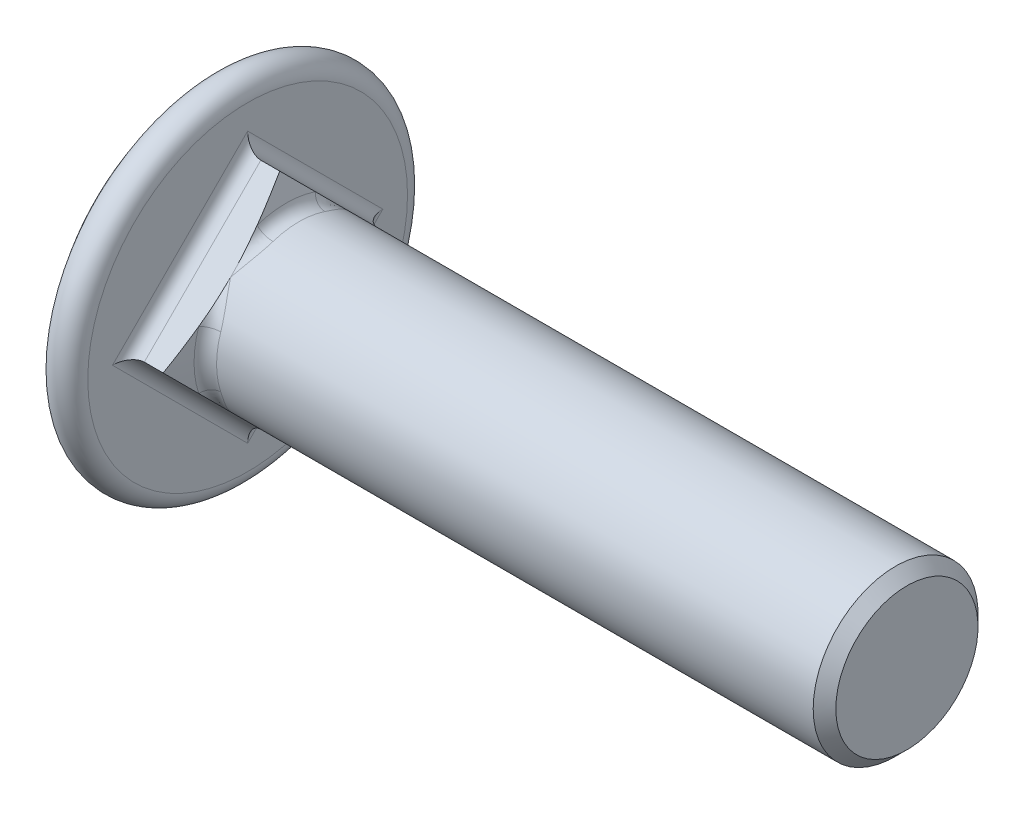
SolidWorks part; units mm, degrees
revolve "Base-Revolve" add sketch "BodySke" angle 360 about L6
sketch "BodySke" plane through (0, 0, 0) normal (0, 0, 1) x (1, 0, 0)
  line L0 (8.8, 19.4) -> (8.8, 21.5) construction
  line L1 (6.7, 21.5) -> (10.9, 21.5) construction
  line L2 (10.9, 19.4) -> (10.9, 10)
  line L3 (10.9, 10) -> (89.526, 10)
  line L4 (90.9, 8.626) -> (90.9, 0)
  line L5 (90.9, 0) -> (0, 0)
  line L6 (-31.75, 0) -> (127, 0) construction
  line L8 (90.9, 8.626) -> (89.526, 10)
  line L10 (90.9, -8.626) -> (89.526, -10) construction
  line L11 (13.4, 7.799) -> (13.4, 1.449) construction
  line L12 (30.9, 7.799) -> (30.9, 1.449) construction
  line L13 (30.9, 7.799) -> (30.9, 1.449) construction
  arc A0 (7.1476, 20.6959) -> (0, 0) centre (33.5366, 0) ccw
  arc A1 (10.9, 19.4) -> (7.1476, 20.6959) centre (8.8, 19.4) ccw
ref_plane "Plane1" through (0, 0, 0) normal (0, 0, 1) x (1, 0, 0)
ref_plane "Plane2" through (0, 0, 0) normal (0, 1, 0) x (1, 0, 0)
ref_plane "Plane3" through (0, 0, 0) normal (1, 0, 0) x (0, 0, -1)
other "Configuration Table"
sketch "Sketch1" plane through (10.9, 0, 0) normal (1, 0, 0) x (0, 0, -1)
  line L0 (0, 14.1421) -> (14.1421, 0)
  line L1 (14.1421, 0) -> (0, -14.1421)
  line L2 (0, -14.1421) -> (-14.1421, 0)
  line L3 (-14.1421, 0) -> (0, 14.1421)
  circle A0 centre (0, 0) radius 10 construction
extrude "Boss-Extrude1" add sketch "Sketch1" along normal blind 5
sketch "Sketch2" plane through (0, 0, 0) normal (0, 0, 1) x (1, 0, 0)
  line L0 (0, 0) -> (101.6, 0) construction
  line L1 (15.9, 10) -> (20.9, 10)
  line L2 (15.9, 10) -> (12.5506, 22.5)
  line L3 (20.9, 10) -> (20.9, 22.5)
  line L4 (20.9, 22.5) -> (12.5506, 22.5)
revolve "Cut-Revolve1" cut sketch "Sketch2" angle 360 about L0
fillet "Fillet1" radius 1.6 4 edges at (10.9, 7.0711, -7.0711) (10.9, -7.0711, -7.0711) (10.9, 7.0711, 7.0711) (10.9, -7.0711, 7.0711)
fillet "Fillet2" radius 1.6 4 edges at (15.9, 0, 10) (15.9, 10, 0) (15.9, 0, -10) (15.9, -10, 0)
sketch "ThdSchSke" plane through (0, 0, 0) normal (0, 0, 1) x (1, 0, 0)
  line L0 (30.9, -8.626) -> (29.9379, -10)
  line L1 (30.9, -8.626) -> (31.8621, -10)
  line L2 (31.8621, -10) -> (31.8621, -12.5)
  line L3 (0, 0) -> (5.1513, 0) construction
  line L4 (-31.75, 0) -> (127, 0) construction
  line L5 (31.8621, -12.5) -> (29.9379, -12.5)
  line L6 (29.9379, -12.5) -> (29.9379, -10)
  arc A1 (7.1476, 20.6959) -> (7.1476, -20.6959) centre (33.5366, 0) ccw construction
revolve "ThreadSchematic" [suppressed] cut sketch "ThdSchSke" angle 360 about L3
pattern_linear "ThdSchPat" [suppressed]
equation "\"Thread_minor@ThreadCosmetic\"  =  \"Minor_dia@BodySke\""
equation "\"Thread_length@ThreadCosmetic\" = ((sgn( (\"Length@BodySke\" - \"Advance@BodySke\" * 3.0) - \"Thread_nom@BodySke\" )-1)*( (\"Length@BodySke\" - \"Advance@BodySke\" * 3.0) - \"Thread_nom@BodySke\" ))/-2+ \"Thread_no"
equation "\"Thread_minor@ThdSchSke\" = \"Minor_dia@BodySke\""
equation "\"Diameter@ThdSchSke\" = \"Diameter@BodySke\""
equation "\"Overcut@ThdSchSke\" = \"Diameter@BodySke\" * 1.25"
equation "\"Start@ThdSchSke\" = \"Head_ht@BodySke\" + \"Length@BodySke\" - \"Thread_length@ThreadCosmetic\"  '---Non-countersunk---"
equation "\"Num_threads@ThdSchPat\" = int( \"Thread_length@ThreadCosmetic\" / \"Advance@BodySke\" + 0.999 )  + 1"
equation "\"Advance@ThdSchPat\" = \"Thread_length@ThreadCosmetic\" /  (\"Num_threads@ThdSchPat\" - 1) 'relax it"
equation "\"Num_threads@ThdSchPat\" = \"Num_threads@ThdSchPat\" - sgn( \"Num_threads@ThdSchPat\" - 1) '---chamfered tips only---"
equation "\"D1@Sketch2\" = \"Diameter@BodySke\""
equation "\"D2@Sketch2\" = \"Head_ht@BodySke\" + \"NeckHt@Boss-Extrude1\""
equation "\"D3@Sketch2\" = \"Head_dia@BodySke\" + 2"
equation "\"D1@Sketch1\" = \"Diameter@BodySke\""
equation "\"D1@Fillet2\" = \"HeadFilletRad@Fillet1\""
